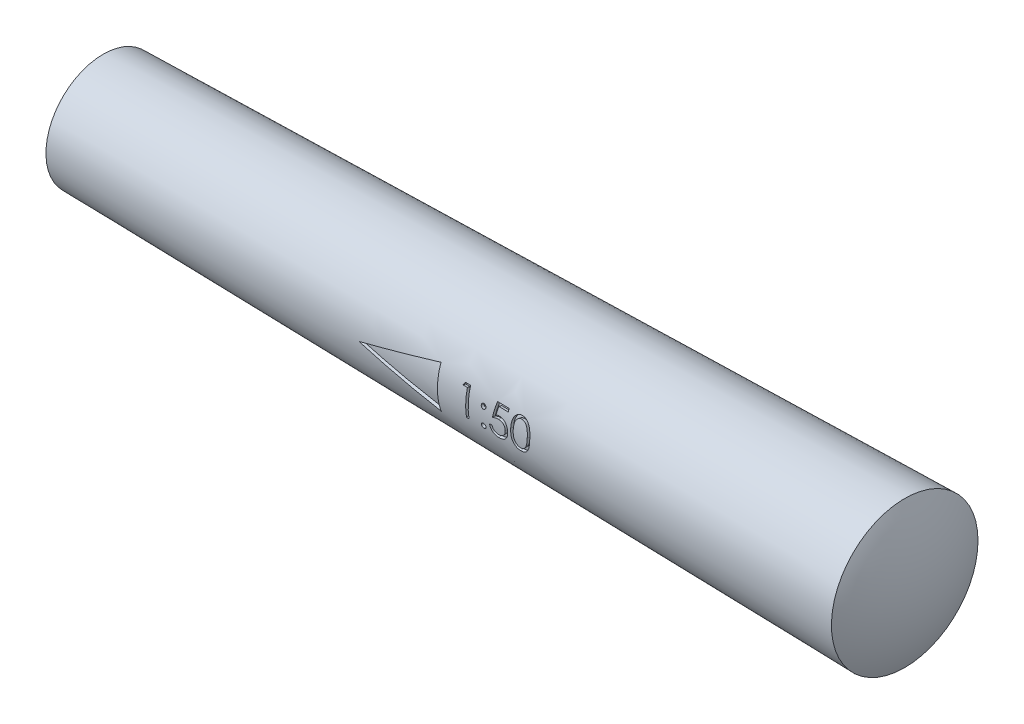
SolidWorks part; units mm, degrees
ref_plane "Front Plane" through (0, 0, 0) normal (0, 0, 1) x (1, 0, 0)
ref_plane "Top Plane" through (0, 0, 0) normal (0, 1, 0) x (1, 0, 0)
ref_plane "Right Plane" through (0, 0, 0) normal (1, 0, 0) x (0, 0, -1)
sketch "Sketch1" plane through (0, 0, 0) normal (1, 0, 0) x (0, 0, -1)
  circle A0 centre (0, 0) radius 2
  dimension "D1" = 4
extrude "Extrude1" add sketch "Sketch1" along normal mid plane 28
draft "Draft1" type of draft neutral plane draft angle 1.146 faces to draft 1 parameters "D1"=1.146
sketch "Sketch2" plane through (0, 0, 0) normal (0, 0, 1) x (1, 0, 0)
  line L0 (-14, 0) -> (-14, 2)
  line L1 (-14, 2) -> (-14, -2) construction
  line L2 (-14, 0) -> (-14.6, 0)
  line L3 (-14.6, 0) -> (-14.6, -2.28) construction
  line L4 (14, 0) -> (14, 2.56)
  line L5 (14, -2.56) -> (14, 2.56) construction
  line L6 (14, 0) -> (14.6, 0)
  line L7 (14.6, 0) -> (14.6, -2.28) construction
  line L8 (-14, -2) -> (14, -2.56) construction
  arc A0 (-14.6, 0) -> (-14, 2) centre (-10.9667, 0) cw
  arc A1 (14.6, 0) -> (14, 2.56) centre (8.8386, 0) ccw
  point P14 (0, -2.28)
revolve "Revolve1" add sketch "Sketch2" angle 360 about L2
sketch "Sketch5" plane through (0, 0, 0) normal (0, 0, 1) x (1, 0, 0)
  line L0 (0, 2.28) -> (0, -2.28) construction
  line L1 (14, 2.56) -> (-14, 2) construction
  line L2 (-14, -2) -> (14, -2.56) construction
ref_plane "Plane2" through (0, 0, 0) normal (-0.02, 0, 0.9998) x (0.9998, 0, 0.02)
sketch "Sketch6" plane through (0, 0, 0) normal (-0.02, 0, 0.9998) x (0.9998, 0, 0.02)
  line L0 (0, 0) -> (0, 0.75)
  line L1 (0, 2.28) -> (0, -2.28) construction
  line L2 (0, 0.75) -> (-2.799, 0)
  line L3 (-2.799, 0) -> (0, -0.75)
  line L4 (0, -0.75) -> (0, 0)
  line L5 (0, -0.375) -> (4, -0.375) construction
  text T0 "1:50" font "Century Gothic" height 1
  dimension "D1" = 1.5
  dimension "D2" = 30
  dimension "D3" = 4
wrap "Wrap2" sketch "Sketch6" wrap type deboss source sketch "Sketch6" thickness 0.1 parameters "D1"=0.1
equation "\"D2@Sketch2\" = \"D1@Sketch2\""
